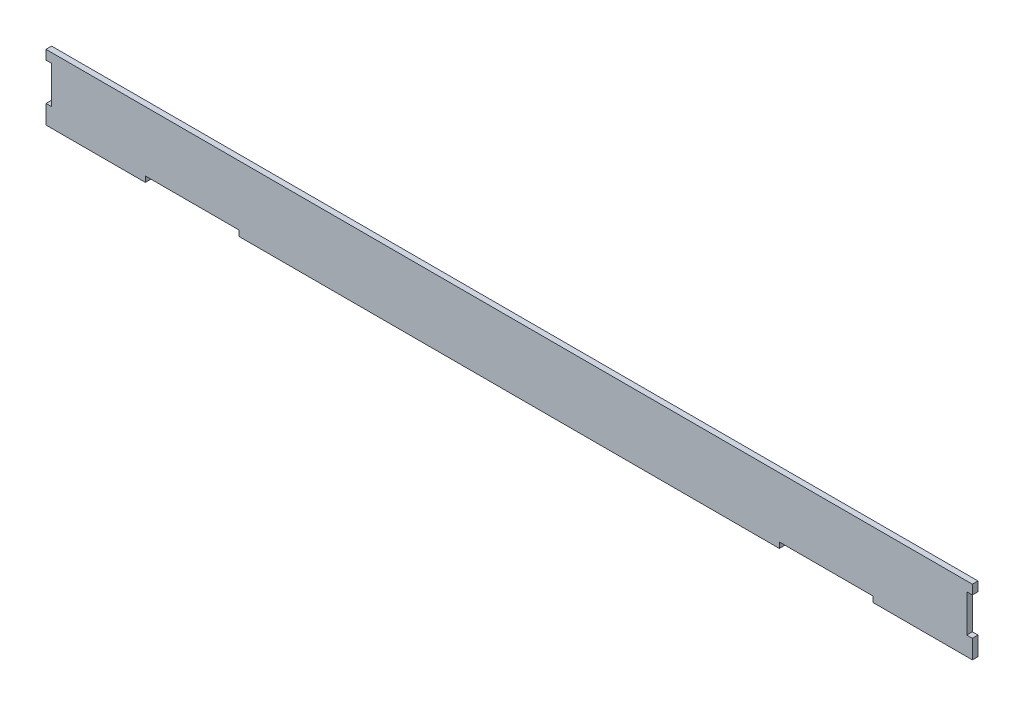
SolidWorks part; units mm, degrees
ref_plane "Front Plane" through (0, 0, 0) normal (0, 0, 1) x (1, 0, 0)
ref_plane "Top Plane" through (0, 0, 0) normal (0, 1, 0) x (1, 0, 0)
ref_plane "Right Plane" through (0, 0, 0) normal (1, 0, 0) x (0, 0, -1)
sketch "Sketch2" plane through (0, 0, 0) normal (0, 0, 1) x (1, 0, 0)
  line L0 (103, 0) -> (391.4, 0)
  line L1 (0, 0) -> (53, 0)
  line L2 (0, 0) -> (0, 10)
  line L3 (0, 35) -> (494.4, 35)
  line L4 (494.4, 0) -> (494.4, 10)
  line L6 (53, 0) -> (53, 3)
  line L7 (53, 3) -> (103, 3)
  line L8 (103, 0) -> (103, 3)
  line L10 (391.4, 0) -> (391.4, 3)
  line L11 (391.4, 3) -> (441.4, 3)
  line L12 (441.4, 0) -> (441.4, 3)
  line L13 (441.4, 0) -> (494.4, 0)
  line L14 (247.2, 116.0079) -> (247.2, -36.744) construction
  line L15 (0, 10) -> (3, 10)
  line L17 (0, 30) -> (3, 30)
  line L18 (3, 10) -> (3, 30)
  line L19 (494.4, 10) -> (491.4, 10)
  line L20 (491.4, 10) -> (491.4, 30)
  line L21 (494.4, 30) -> (491.4, 30)
  line L22 (0, 30) -> (0, 35)
  line L23 (494.4, 30) -> (494.4, 35)
  dimension "D1" = 494.4
  dimension "D2" = 35
  dimension "D3" = 53
  dimension "D4" = 50
  dimension "D5" = 50
  dimension "D6" = 53
  dimension "D7" = 3
  dimension "D8" = 3
  dimension "D9" = 10
  dimension "D10" = 20
  dimension "D11" = 3
extrude "Boss-Extrude1" add sketch "Sketch2" along normal blind 3
